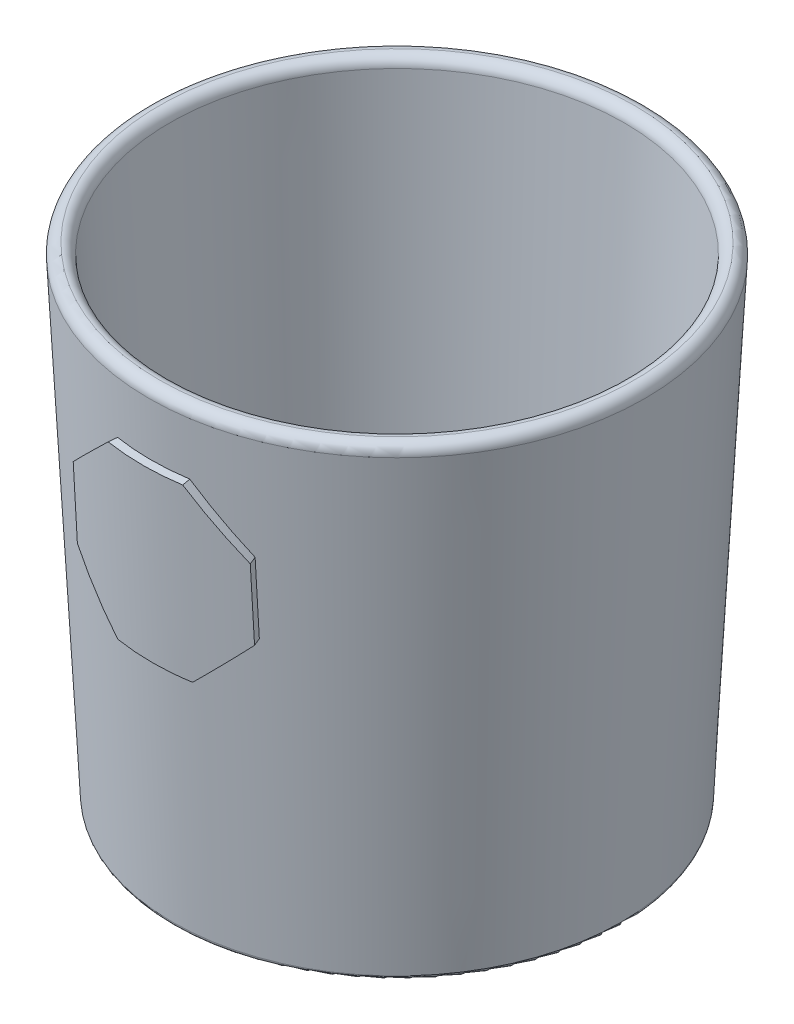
SolidWorks part; units mm, degrees
ref_plane "Plan de face" through (0, 0, 0) normal (0, 0, 1) x (1, 0, 0)
ref_plane "Plan de dessus" through (0, 0, 0) normal (0, 1, 0) x (1, 0, 0)
ref_plane "Plan de droite" through (0, 0, 0) normal (1, 0, 0) x (0, 0, -1)
sketch "Esquisse1" plane through (0, 0, 0) normal (0, 0, 1) x (1, 0, 0)
  line L0 (0, 0) -> (0, 56)
  line L1 (0, 56) -> (-30, 56)
  line L2 (-30, 56) -> (-27, -2)
  line L3 (-27, -2) -> (-25, -2)
  line L4 (-1.4575, 0) -> (0, 0)
  spline S0 degree 3 poles (-25, -2) (-17.2167, 0.0866) (-9.335, -0.0028) (-1.4575, 0) knots 0 0 0 0 1 1 1 1
  dimension "D1" = 58
  dimension "D2" = 30
  dimension "D4" = 2
  dimension "D5" = 27
revolve "Révolution1" add sketch "Esquisse1" angle 360 about L0
shell "Coque1" thickness 2.5
fillet "Congé1" radius 1.25 2 edges at (0, 56, -30) (0, 56, -27.4967)
fillet "Congé2" radius 0.5 1 edges at (0, -2, -27)
ref_plane "Plan1" through (0, 0, 30) normal (0, 0, 1) x (1, 0, 0)
sketch "Esquisse2" plane through (0, 0, 30) normal (0, 0, 1) x (1, 0, 0)
  line L1 (4.3125, 26.8788) -> (10.5142, 33.0806)
  line L2 (10.5142, 33.0806) -> (10.5142, 41.8512)
  line L3 (10.5142, 41.8512) -> (4.3125, 48.0529)
  line L4 (4.3125, 48.0529) -> (-4.4581, 48.0529)
  line L5 (-4.4581, 48.0529) -> (-10.6599, 41.8512)
  line L6 (-10.6599, 41.8512) -> (-10.6599, 33.0806)
  line L7 (-10.6599, 33.0806) -> (-4.4581, 26.8788)
  line L8 (-4.4581, 26.8788) -> (4.3125, 26.8788)
  circle A0 centre (-0.0728, 37.4659) radius 10.587 construction
  point P1 (0, 37.5252)
wrap "Enroulement1" sketch "Esquisse2" wrap type emboss source sketch "Esquisse2" thickness 1 parameters "D1"=1
mirror "Symétrie1" about plane through (0, 0, 0) normal (0, 0, 1) of "Enroulement1"
